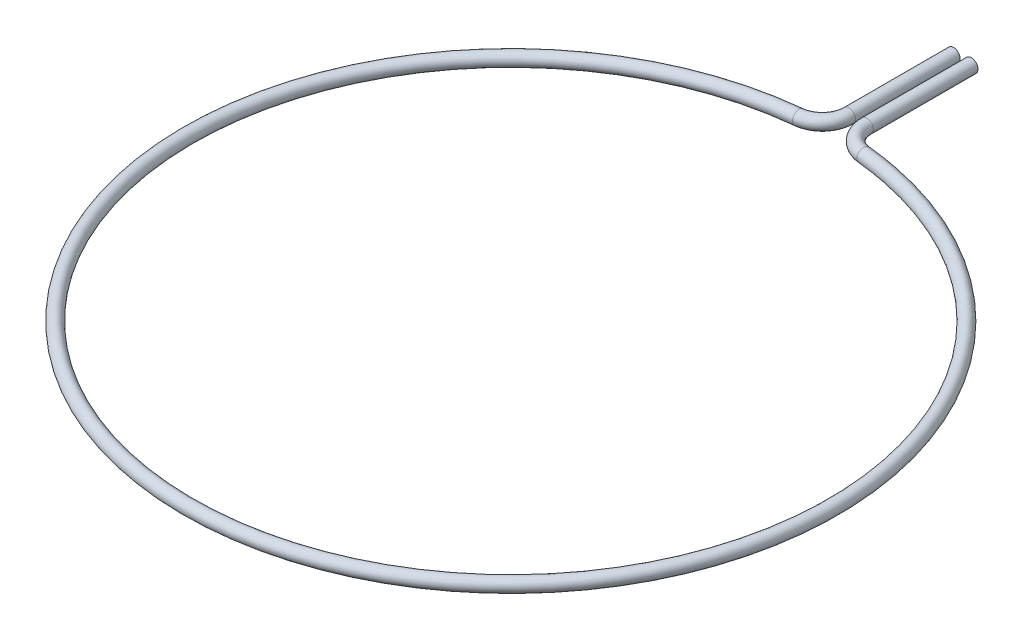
SolidWorks part; units mm, degrees
ref_plane "前视基准面" through (0, 0, 0) normal (0, 0, 1) x (1, 0, 0)
ref_plane "上视基准面" through (0, 0, 0) normal (0, 1, 0) x (1, 0, 0)
ref_plane "右视基准面" through (0, 0, 0) normal (1, 0, 0) x (0, 0, -1)
sketch "草图1" plane through (0, 0, 0) normal (0, 1, 0) x (1, 0, 0)
  line L0 (-4, 203.3974) -> (-4, 156.2831)
  line L1 (4, 203.3974) -> (4, 156.2831)
  line L2 (0, 44.502) -> (0, -45.7938) construction
  arc A0 (14.7778, 144.3455) -> (-14.7778, 144.3455) centre (0, 0) cw
  arc A1 (4, 156.2831) -> (14.7778, 144.3455) centre (16, 156.2831) ccw
  arc A2 (-4, 156.2831) -> (-14.7778, 144.3455) centre (-16, 156.2831) cw
  point P10 (0, 0)
  point P13 (4, 203.3974)
  dimension "D1" = 145.1
  dimension "D2" = 8
  dimension "D3" = 12
  dimension "D4" = 12
sketch3d "3D草图1"
  line L0 (4, 0, -203.3974) -> (4, 0, -156.2831) construction
  circle A0 centre (4, 0, -203.3974) radius 3
  point P2 (4, 0, -200.3974)
  point P5 (0, 0, 0)
  point P6 (0, 0, 0)
  point P8 (4, 0, -203.3974)
  dimension "D1" = 6
sweep "扫描1" add profiles "3D草图1" path "草图1"
